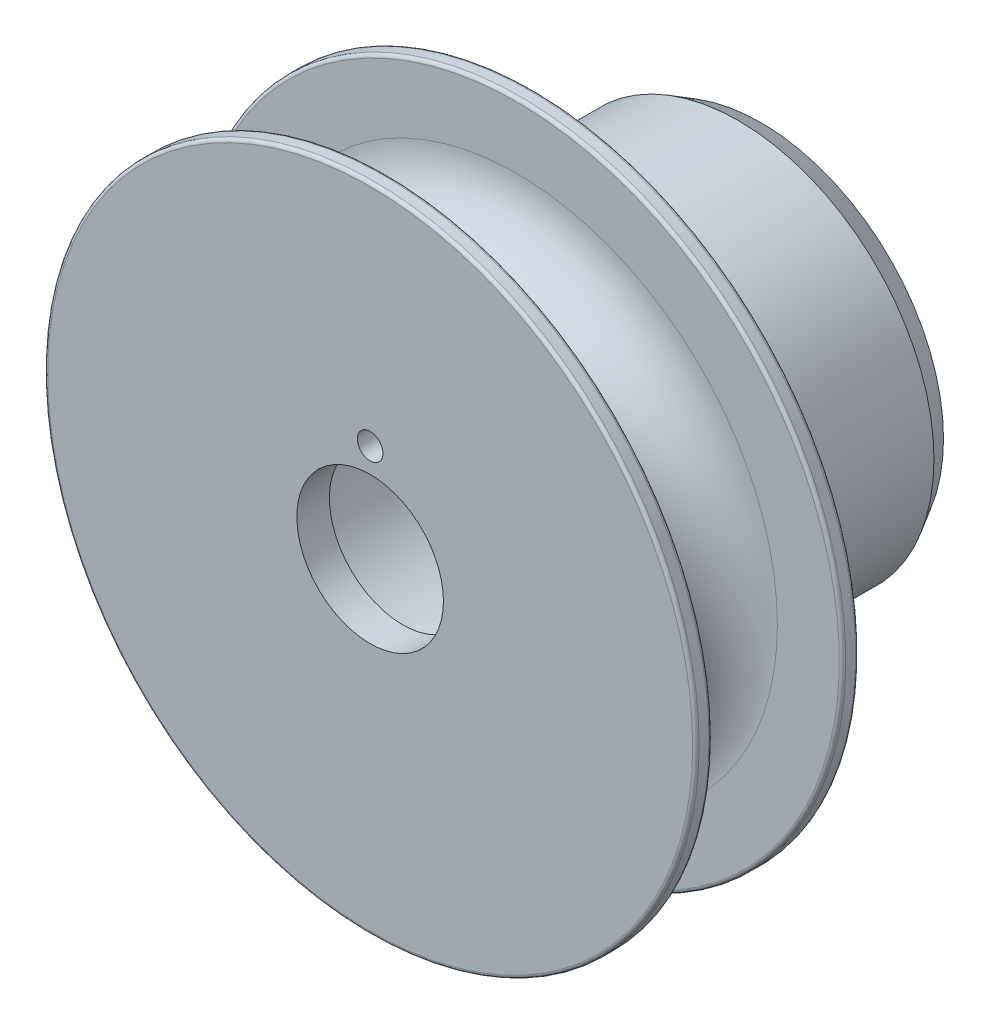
SolidWorks part; units mm, degrees
ref_plane "Front Plane" through (0, 0, 0) normal (0, 0, 1) x (1, 0, 0)
ref_plane "Top Plane" through (0, 0, 0) normal (0, 1, 0) x (1, 0, 0)
ref_plane "Right Plane" through (0, 0, 0) normal (1, 0, 0) x (0, 0, -1)
sketch "Sketch1" plane through (0, 0, 0) normal (0, 0, 1) x (1, 0, 0)
  line L0 (0, 0) -> (0, 19.05) construction
  line L1 (-6.1226, 21.2784) -> (6.1226, 16.8216) construction
  circle A0 centre (0, 0) radius 17.0656 construction
  circle A1 centre (0, 0) radius 20.6375 construction
  circle A2 centre (0, 0) radius 19.05 construction
  circle A3 centre (0, 0) radius 17.9011 construction
  point P8 (203.2, 0)
  point P13 (304.8, 0)
sketch "Sketch2" plane through (0, 0, 0) normal (1, 0, 0) x (0, 0, -1)
  line L0 (-152.4, 0) -> (152.4, 0) construction
  point P2 (-131.7625, 0)
  point P5 (-121.4438, 0)
  point P6 (131.7625, 0)
sketch "Sketch3" plane through (0, 0, 0) normal (0, 0, 1) x (1, 0, 0)
  circle A0 centre (0, 0) radius 20.6375
  circle A1 centre (0, 0) radius 20.6375 construction
extrude "Boss-Extrude1" add sketch "Sketch3" against normal up to vertex and the other way up to vertex
sketch "Sketch4" plane through (0, 0, 0) normal (0, 0, 1) x (1, 0, 0)
  line L0 (0, 0) -> (17.0438, 0.8622) construction
  line L2 (0, 0) -> (17.0438, -0.8622) construction
  line L4 (17.0438, 0.8622) -> (17.8783, 0.9044)
  line L5 (17.8783, -0.9044) -> (17.0438, -0.8622)
  arc A0 (17.0438, 0.8622) -> (17.0438, -0.8622) centre (0, 0) cw
  arc A3 (20.5273, 2.1297) -> (20.5273, -2.1297) centre (0, 0) cw
  circle A4 centre (0, 0) radius 20.6375 construction
  spline S0 degree 4 poles (17.8783, 0.9044) (17.8826, 0.9047) (17.8948, 0.9056) (17.9178, 0.908) (17.9552, 0.9129) (18.0028, 0.9204) (18.0642, 0.9316) (18.1363, 0.9468) (18.2153, 0.9656) (18.3009, 0.9883) (18.3861, 1.013) (18.4708, 1.0393) (18.5549, 1.0673) (18.6565, 1.1031) (18.7778, 1.1487) (18.9188, 1.2059) (19.0779, 1.2755) (19.2391, 1.3513) (19.3967, 1.43) (19.555, 1.5141) (19.7073, 1.5988) (19.8644, 1.6914) (20.0088, 1.7793) (20.1693, 1.883) (20.2983, 1.9682) (20.4671, 2.0861) (20.5663, 2.1574) (20.6818, 2.2427) (20.7328, 2.2815) (20.7642, 2.3054) knots 0 0 0 0 0 0.005377 0.015084 0.028532 0.04661 0.064855 0.092111 0.119476 0.146842 0.174209 0.201575 0.228941 0.256307 0.307035 0.361767 0.4165 0.471232 0.525964 0.580697 0.635429 0.690161 0.744894 0.799626 0.854358 0.909091 0.954545 1 1 1 1 1 construction
  spline S1 degree 4 poles (17.8783, 0.9044) (17.8826, 0.9047) (17.8948, 0.9056) (17.9178, 0.908) (17.9552, 0.9129) (18.0028, 0.9204) (18.0642, 0.9316) (18.1363, 0.9468) (18.2153, 0.9656) (18.3009, 0.9883) (18.3861, 1.013) (18.4708, 1.0393) (18.5549, 1.0673) (18.6565, 1.1031) (18.7778, 1.1487) (18.9188, 1.2059) (19.0779, 1.2755) (19.2391, 1.3513) (19.3967, 1.43) (19.555, 1.5141) (19.7073, 1.5988) (19.8644, 1.6914) (20.0088, 1.7793) (20.1693, 1.883) (20.2983, 1.9682) (20.4305, 2.0606) (20.4946, 2.1061) (20.5273, 2.1297) knots 0 0 0 0 0 0.005377 0.015084 0.028532 0.04661 0.064855 0.092111 0.119476 0.146842 0.174209 0.201575 0.228941 0.256307 0.307035 0.361767 0.4165 0.471232 0.525964 0.580697 0.635429 0.690161 0.744894 0.799626 0.854358 0.909091 0.909091 0.909091 0.909091 0.909091
  spline S2 degree 4 poles (17.8783, -0.9044) (17.8826, -0.9047) (17.8948, -0.9056) (17.9178, -0.908) (17.9552, -0.9129) (18.0028, -0.9204) (18.0642, -0.9316) (18.1363, -0.9468) (18.2153, -0.9656) (18.3009, -0.9883) (18.3861, -1.013) (18.4708, -1.0393) (18.5549, -1.0673) (18.6565, -1.1031) (18.7778, -1.1487) (18.9188, -1.2059) (19.0779, -1.2755) (19.2391, -1.3513) (19.3967, -1.43) (19.555, -1.5141) (19.7073, -1.5988) (19.8644, -1.6914) (20.0088, -1.7793) (20.1693, -1.883) (20.2983, -1.9682) (20.4671, -2.0861) (20.5663, -2.1574) (20.6818, -2.2427) (20.7328, -2.2815) (20.7642, -2.3054) knots 0 0 0 0 0 0.005377 0.015084 0.028532 0.04661 0.064855 0.092111 0.119476 0.146842 0.174209 0.201575 0.228941 0.256307 0.307035 0.361767 0.4165 0.471232 0.525964 0.580697 0.635429 0.690161 0.744894 0.799626 0.854358 0.909091 0.954545 1 1 1 1 1 construction
  spline S3 degree 4 poles (17.8783, -0.9044) (17.8826, -0.9047) (17.8948, -0.9056) (17.9178, -0.908) (17.9552, -0.9129) (18.0028, -0.9204) (18.0642, -0.9316) (18.1363, -0.9468) (18.2153, -0.9656) (18.3009, -0.9883) (18.3861, -1.013) (18.4708, -1.0393) (18.5549, -1.0673) (18.6565, -1.1031) (18.7778, -1.1487) (18.9188, -1.2059) (19.0779, -1.2755) (19.2391, -1.3513) (19.3967, -1.43) (19.555, -1.5141) (19.7073, -1.5988) (19.8644, -1.6914) (20.0088, -1.7793) (20.1693, -1.883) (20.2983, -1.9682) (20.4305, -2.0606) (20.4946, -2.1061) (20.5273, -2.1297) knots 0 0 0 0 0 0.005377 0.015084 0.028532 0.04661 0.064855 0.092111 0.119476 0.146842 0.174209 0.201575 0.228941 0.256307 0.307035 0.361767 0.4165 0.471232 0.525964 0.580697 0.635429 0.690161 0.744894 0.799626 0.854358 0.909091 0.909091 0.909091 0.909091 0.909091
extrude "Cut-Extrude1" cut sketch "Sketch4" against normal through all both and the other way through all
fillet "Fillet1" radius 0.5326 2 edges at (17.0438, -0.8622, 0) (17.0438, 0.8622, 0)
pattern_circular "CirPattern1" count 24 over 360 about axis through (0, 0, 152.4) along (0, 0, -1) of "Cut-Extrude1", "Fillet1"
sketch "Sketch6" plane through (0, 0, 152.4) normal (0, 0, 1) x (1, 0, 0)
  circle A0 centre (-38.1, 0) radius 673.6155
  circle A1 centre (0, 0) radius 38.1 construction
extrude "Cut-Extrude2" cut sketch "Sketch6" against normal blind 177.8
sketch "Sketch7" plane through (0, 0, -25.4) normal (0, 0, 1) x (1, 0, 0)
  circle A0 centre (0, 0) radius 22.225
  circle A1 centre (0, 0) radius 38.1
  dimension "D1" = 76.2
  dimension "D2" = 44.45
extrude "Boss-Extrude2" add sketch "Sketch7" against normal blind 76.2 separate body
sketch "Sketch8" plane through (0, 0, -25.4) normal (0, 0, 1) x (1, 0, 0)
  circle A0 centre (0, 0) radius 38.1 construction
  circle A1 centre (0, 0) radius 38.1
  circle A2 centre (0, 0) radius 63.5
  dimension "D1" = 25.4
extrude "Boss-Extrude3" add sketch "Sketch8" against normal blind 3.175
ref_plane "Plane1" through (0, 0, -41.275) normal (0, 0, 1) x (1, 0, 0)
mirror "Mirror2" about plane through (0, 0, -41.275) normal (0, 0, 1) of "Boss-Extrude3"
fillet "Fillet2" radius 12.7 3 edges at (38.1, 0, -53.975) (-38.1, 0, -57.15) (38.1, 0, -28.575)
fillet "Fillet3" radius 0.635 4 edges at (63.5, 0, -28.575) (63.5, 0, -53.975) (63.5, 0, -57.15) (63.5, 0, -25.4)
sketch "Sketch9" plane through (0, 0, -25.4) normal (0, 0, 1) x (1, 0, 0)
  circle A0 centre (0, 0) radius 22.225 construction
  circle A1 centre (0, 0) radius 22.225
sketch "Sketch10" plane through (0, 0, -25.4) normal (0, 0, 1) x (1, 0, 0)
  circle A0 centre (0, 0) radius 22.225 construction
  circle A1 centre (0, 0) radius 22.225
extrude "Cut-Extrude3" cut sketch "Sketch10" against normal blind 370.586
sketch "Sketch11" plane through (0, 0, -25.4) normal (0, 0, 1) x (1, 0, 0)
  circle A0 centre (0, 0) radius 22.225 construction
  circle A1 centre (0, 0) radius 22.225
  circle A2 centre (0, 0) radius 14.2875
  circle A3 centre (0, 19.05) radius 2.4892
  dimension "D1" = 28.575
  dimension "D2" = 4.9784
  dimension "D3" = 19.05
extrude "Boss-Extrude5" add sketch "Sketch11" against normal blind 6.35 contours A3 A2 M2
sketch "Sketch12" plane through (0, 0, 0) normal (1, 0, 0) x (0, 0, -1)
  line L0 (101.6, -38.1) -> (101.6, 38.1) construction
  circle A0 centre (85.09, 0) radius 9.625
  point P2 (0, 0)
  dimension "D1" = 19.25
  dimension "D2" = 16.51
extrude "Cut-Extrude4" cut sketch "Sketch12" against normal blind 86.868
chamfer "Chamfer1" distance 2.54 angle 60 2 edges at (22.225, 0, -101.6) (38.1, 0, -101.6)
equation "\"Root Diameter@Sketch1\"=\"Root Diameter\""
equation "\"OD | Outside Diameter@Sketch1\"=\"Outside Diameter\""
equation "\"D1@CirPattern1\"=\"Number of Teeth\""
equation "\"Diametral Pitch\"= 16"
equation "\"Number of Teeth\"= 24"
equation "\"Pressure Angle\"=20"
equation "\"Pitch Diameter\"= \"Number of Teeth\" / \"Diametral Pitch\""
equation "\"Base Diameter\"= \"Pitch Diameter\" * cos ( \"Pressure Angle\" )"
equation "\"Outside Diameter\"= ( \"Number of Teeth\" + 2 ) / \"Diametral Pitch\""
equation "\"Dedendum\"= 1.25 / \"Diametral Pitch\""
equation "\"Root Diameter\"= \"Pitch Diameter\" - ( 2 * \"Dedendum\" )"
equation "\"Pitch Angle\"= 360deg / \"Number of Teeth\""
equation "\"Alpha\"= sqr ( \"Pitch Diameter\" ^ 2 - \"Base Diameter\" ^ 2 ) / \"Base Diameter\" * 180 / PI - \"Pressure Angle\""
equation "\"Beta\"= ( \"Pitch Angle\" / 4 - \"Alpha\" )"
equation "\"Phi\"= sqr ( ( \"Outside Diameter\" / 2 ) ^ 2 - ( \"Base Diameter\" / 2 ) ^ 2 ) / ( \"Base Diameter\" / 2 )"
equation "\"Addendum\"= 1 / \"Diametral Pitch\""
equation "\"WorkingDepth\"= 2 / \"Diametral Pitch\""
equation "\"WholeDepth\"= 2.25 / \"Diametral Pitch\""
equation "\"Clearance\"= 0.25 / \"Diametral Pitch\""
equation "\"ToothThickness\"= ( pi * 2 ) / \"Diametral Pitch\""
equation "\"CircularPitch\"= pi / \"Diametral Pitch\""
equation "\"Number of Teeth@Sketch1\"=\"Number of Teeth\""
equation "\"Gear Pitch | Diametral Pitch@Sketch1\"=\"Diametral Pitch\""
equation "\"Pressure Angle@Sketch1\"=\"Pressure Angle\""
equation "\"Gear Pitch Diameter@Sketch1\"=\"Pitch Diameter\""
equation "\"Base Diameter@Sketch1\"=\"Base Diameter\""
equation "\"Fillet\"= \"Clearance\" * cos ( \"Pressure Angle\" ) * tan ( ( 90 + \"Pressure Angle\" ) / 2 )"
equation "\"D1@Fillet1\"=\"Fillet\""
equation "\"D1@Sketch4\"=if( \"Base Diameter\">\"Root Diameter\",\"Root Diameter\",\"Base Diameter\"-.00001)"
equation "\"D1@Sketch2\"=\"OD | Outside Diameter@Sketch1\"*2*0.5*0.5"
equation "\"D2@Sketch2\"=\"D1@Sketch2\"*1.5"
equation "\"D3@Sketch2\"=\"D1@Sketch2\""
